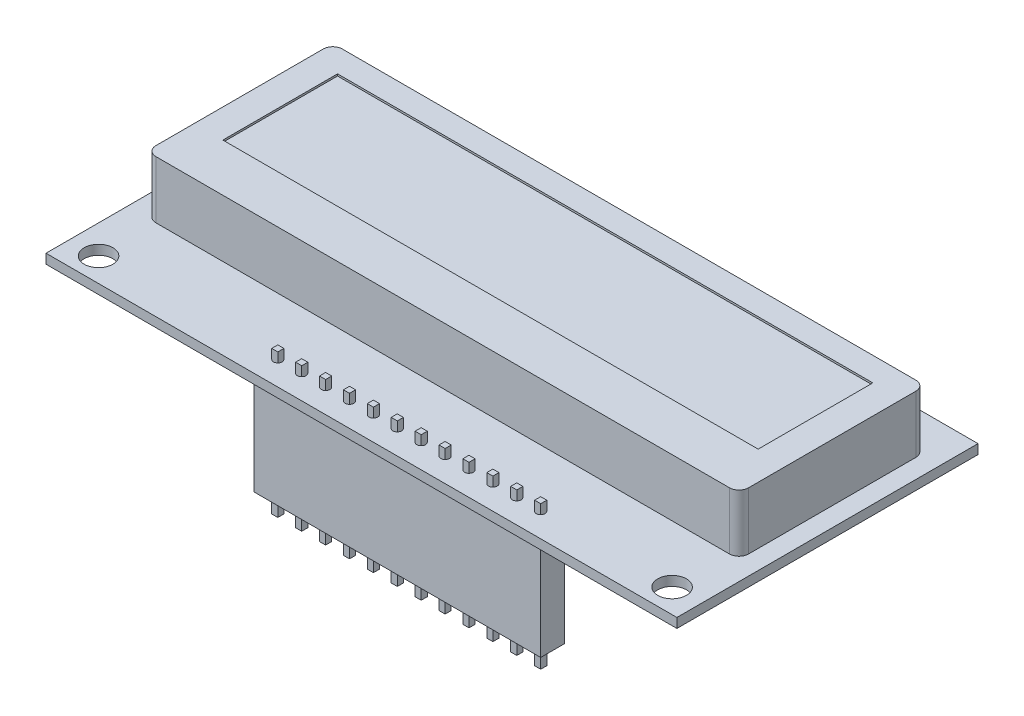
SolidWorks part; units mm, degrees
ref_plane "Front" through (0, 0, 0) normal (0, 0, 1) x (1, 0, 0)
ref_plane "Top" through (0, 0, 0) normal (0, 1, 0) x (1, 0, 0)
ref_plane "Right" through (0, 0, 0) normal (1, 0, 0) x (0, 0, -1)
sketch "Эскиз1" plane through (0, 0, 0) normal (0, 1, 0) x (1, 0, 0)
  line L0 (-33, 0) -> (33, 0) construction
  line L1 (-33, -19.5) -> (33, -19.5)
  line L2 (-33, -19.5) -> (-33, 12)
  line L3 (-33, 12) -> (33, 12)
  line L4 (33, -19.5) -> (33, 12)
  dimension "D1" = 66
  dimension "D2" = 31.5
  dimension "D3" = 19.5
extrude "Вытянуть1" add sketch "Эскиз1" along normal blind 1 from offset 11
sketch "Эскиз2" plane through (0, 12, 0) normal (0, 1, 0) x (1, 0, 0)
  line L0 (-33, -19.5) -> (33, -19.5) construction
  line L1 (31, -11) -> (-31, -11)
  line L2 (31, -11) -> (31, 8.5)
  line L3 (31, 8.5) -> (-31, 8.5)
  line L4 (-31, -11) -> (-31, 8.5)
  line L5 (31, -11) -> (-31, 8.5) construction
  line L6 (31, 8.5) -> (-31, -11) construction
  point P0 (0, -1.25)
  dimension "D1" = 8.5
  dimension "D2" = 19.5
  dimension "D3" = 62
extrude "Вытянуть2" add sketch "Эскиз2" along normal blind 6
fillet "Скругление1" radius 1 4 edges at (31, 15, 11) (31, 15, -8.5) (-31, 15, -8.5) (-31, 15, 11)
sketch "Эскиз3" plane through (0, 18, 0) normal (0, 1, 0) x (1, 0, 0)
  line L0 (-30, -11) -> (30, -11) construction
  line L1 (28, -6) -> (-28, -6)
  line L2 (28, -6) -> (28, 6)
  line L3 (28, 6) -> (-28, 6)
  line L4 (-28, -6) -> (-28, 6)
  line L5 (28, -6) -> (-28, 6) construction
  line L6 (28, 6) -> (-28, -6) construction
  point P0 (0, 0)
  dimension "D1" = 56
  dimension "D2" = 12
  dimension "D3" = 5
extrude "Вытянуть3" cut sketch "Эскиз3" against normal blind 0.2
sketch "Эскиз4" plane through (0, 11, 0) normal (0, -1, 0) x (1, 0, 0)
  line L0 (-2.5, -7.7) -> (-2.5, -8.5)
  line L1 (-26.5, -7.7) -> (-21.5, -7.7)
  line L2 (-26.5, -7.7) -> (-26.5, -8.5)
  line L3 (-26.5, -8.5) -> (-21.5, -8.5)
  line L4 (-21.5, -7.7) -> (-21.5, -8.5)
  line L5 (-26.5, -7.7) -> (-21.5, -8.5) construction
  line L6 (-26.5, -8.5) -> (-21.5, -7.7) construction
  line L7 (-2.5, -8.5) -> (2.5, -8.5)
  line L8 (-2.5, -7.7) -> (2.5, -7.7)
  line L9 (2.5, -7.7) -> (2.5, -8.5)
  line L10 (21.5, -7.7) -> (21.5, -8.5)
  line L11 (21.5, -8.5) -> (26.5, -8.5)
  line L12 (21.5, -7.7) -> (26.5, -7.7)
  line L13 (26.5, -7.7) -> (26.5, -8.5)
  line L14 (-26.5, 11) -> (-26.5, 10.2)
  line L15 (-26.5, 10.2) -> (-21.5, 10.2)
  line L16 (-26.5, 11) -> (-21.5, 11)
  line L17 (-21.5, 11) -> (-21.5, 10.2)
  line L18 (-2.5, 11) -> (-2.5, 10.2)
  line L19 (-2.5, 10.2) -> (2.5, 10.2)
  line L20 (-2.5, 11) -> (2.5, 11)
  line L21 (2.5, 11) -> (2.5, 10.2)
  line L22 (21.5, 11) -> (21.5, 10.2)
  line L23 (21.5, 10.2) -> (26.5, 10.2)
  line L24 (21.5, 11) -> (26.5, 11)
  line L25 (26.5, 11) -> (26.5, 10.2)
  line L26 (0, 0) -> (0, -7.7) construction
  line L30 (31, 11) -> (-31, 11)
  line L31 (-31, 11) -> (-31, -8.5)
  line L32 (-31, -8.5) -> (31, -8.5)
  line L33 (31, -8.5) -> (31, 11)
  line L34 (31, 11) -> (-31, 11) construction
  line L35 (-31, 11) -> (-31, -8.5) construction
  line L36 (-31, -8.5) -> (31, -8.5) construction
  line L37 (31, -8.5) -> (31, 11) construction
  point P0 (-24, -8.1)
  dimension "D2" = 5
  dimension "D3" = 0.8
  dimension "D4" = 24
  dimension "D1" = 0
extrude "Вытянуть4" add sketch "Эскиз4" along normal blind 2.5
hole_wizard "Диаметр отверстия Ø3.0 (3)1" positions "Эскиз6" profile "Эскиз7" hole size "Ø3.0" standard "ГОСТ"
sketch "Эскиз6" plane through (0, 12, 0) normal (0, 1, 0) x (-1, 0, 0)
  line L0 (0, 0) -> (0, 19.5) construction
  line L1 (33, 19.5) -> (-33, 19.5) construction
  point P0 (30, 17)
  point P1 (-30, 17)
  dimension "D1" = 60
  dimension "D2" = 2.5
sketch "Эскиз7" plane through (-30, 12, 17) normal (1, 0, 0) x (0, 0, 1)
  line L0 (0, 0) -> (0, 3.5)
  line L1 (0, 3.5) -> (1.5, 3.5)
  line L2 (1.5, 3.5) -> (1.5, 0)
  line L5 (1.5, 0) -> (0, 0)
  line L11 (0, -6.35) -> (0, 107.95) construction
  dimension "Диаметр сквозного отверстия" = 3
  dimension "Глубина сквозного отверстия" = 3.5
hole_wizard "Диаметр отверстия Ø0.9 (0.9)1" positions "Эскиз9" profile "Эскиз8" hole size "Ø0.9" standard "ГОСТ"
sketch "Эскиз9" plane through (0, 12, 0) normal (0, 1, 0) x (-1, 0, 0)
  line L0 (33, 19.5) -> (-33, 19.5) construction
  point P0 (11.25, 17)
  point P7 (8.75, 17)
  point P8 (6.25, 17)
  point P9 (3.75, 17)
  point P10 (1.25, 17)
  point P11 (-1.25, 17)
  point P12 (-3.75, 17)
  point P13 (-6.25, 17)
  point P14 (-8.75, 17)
  point P15 (-11.25, 17)
  point P16 (-13.75, 17)
  point P17 (-16.25, 17)
  dimension "D1" = 2.5
  dimension "D2" = 2.5
  dimension "D3" = 1.25
sketch "Эскиз8" plane through (-11.25, 12, 17) normal (1, 0, 0) x (0, 0, 1)
  line L0 (0, 0) -> (0, 3.5)
  line L1 (0, 3.5) -> (0.45, 3.5)
  line L2 (0.45, 3.5) -> (0.45, 0)
  line L5 (0.45, 0) -> (0, 0)
  line L11 (0, -6.35) -> (0, 107.95) construction
  dimension "Диаметр сквозного отверстия" = 0.9
  dimension "Глубина сквозного отверстия" = 3.5
sketch "Эскиз10" plane through (0, 11, 0) normal (0, -1, 0) x (1, 0, 0)
  line L0 (-12.5, 17) -> (17.5, 17) construction
  line L1 (-12.5, 15.75) -> (17.5, 15.75)
  line L2 (-12.5, 15.75) -> (-12.5, 18.25)
  line L3 (-12.5, 18.25) -> (17.5, 18.25)
  line L4 (17.5, 15.75) -> (17.5, 18.25)
  dimension "D1" = 2.5
  dimension "D2" = 1.25
  dimension "D3" = 1.25
extrude "Вытянуть5" add sketch "Эскиз10" along normal blind 11
sketch "Эскиз11" plane through (0, 12, 0) normal (0, 1, 0) x (1, 0, 0)
  line L0 (-9.07, -17.32) -> (-9.07, -16.68)
  line L1 (-11.57, -17.32) -> (-10.93, -17.32)
  line L2 (-11.57, -17.32) -> (-11.57, -16.68)
  line L3 (-11.57, -16.68) -> (-10.93, -16.68)
  line L4 (-10.93, -17.32) -> (-10.93, -16.68)
  line L5 (-11.57, -17.32) -> (-10.93, -16.68) construction
  line L6 (-11.57, -16.68) -> (-10.93, -17.32) construction
  line L7 (-9.07, -16.68) -> (-8.43, -16.68)
  line L8 (-8.43, -17.32) -> (-8.43, -16.68)
  line L9 (-9.07, -17.32) -> (-8.43, -17.32)
  line L10 (-6.57, -17.32) -> (-6.57, -16.68)
  line L11 (-6.57, -16.68) -> (-5.93, -16.68)
  line L12 (-5.93, -17.32) -> (-5.93, -16.68)
  line L13 (-6.57, -17.32) -> (-5.93, -17.32)
  line L14 (-4.07, -17.32) -> (-4.07, -16.68)
  line L15 (-4.07, -16.68) -> (-3.43, -16.68)
  line L16 (-3.43, -17.32) -> (-3.43, -16.68)
  line L17 (-4.07, -17.32) -> (-3.43, -17.32)
  line L18 (-1.57, -17.32) -> (-1.57, -16.68)
  line L19 (-1.57, -16.68) -> (-0.93, -16.68)
  line L20 (-0.93, -17.32) -> (-0.93, -16.68)
  line L21 (-1.57, -17.32) -> (-0.93, -17.32)
  line L22 (0.93, -17.32) -> (0.93, -16.68)
  line L23 (0.93, -16.68) -> (1.57, -16.68)
  line L24 (1.57, -17.32) -> (1.57, -16.68)
  line L25 (0.93, -17.32) -> (1.57, -17.32)
  line L26 (3.43, -17.32) -> (3.43, -16.68)
  line L27 (3.43, -16.68) -> (4.07, -16.68)
  line L28 (4.07, -17.32) -> (4.07, -16.68)
  line L29 (3.43, -17.32) -> (4.07, -17.32)
  line L30 (5.93, -17.32) -> (5.93, -16.68)
  line L31 (5.93, -16.68) -> (6.57, -16.68)
  line L32 (6.57, -17.32) -> (6.57, -16.68)
  line L33 (5.93, -17.32) -> (6.57, -17.32)
  line L34 (8.43, -17.32) -> (8.43, -16.68)
  line L35 (8.43, -16.68) -> (9.07, -16.68)
  line L36 (9.07, -17.32) -> (9.07, -16.68)
  line L37 (8.43, -17.32) -> (9.07, -17.32)
  line L38 (10.93, -17.32) -> (10.93, -16.68)
  line L39 (10.93, -16.68) -> (11.57, -16.68)
  line L40 (11.57, -17.32) -> (11.57, -16.68)
  line L41 (10.93, -17.32) -> (11.57, -17.32)
  line L42 (13.43, -17.32) -> (13.43, -16.68)
  line L43 (13.43, -16.68) -> (14.07, -16.68)
  line L44 (14.07, -17.32) -> (14.07, -16.68)
  line L45 (13.43, -17.32) -> (14.07, -17.32)
  line L46 (15.93, -17.32) -> (15.93, -16.68)
  line L47 (15.93, -16.68) -> (16.57, -16.68)
  line L48 (16.57, -17.32) -> (16.57, -16.68)
  line L49 (15.93, -17.32) -> (16.57, -17.32)
  point P0 (-11.25, -17)
  dimension "D1" = 0.64
  dimension "D2" = 2.5
extrude "Вытянуть6" add sketch "Эскиз11" along normal blind 1 and the other way blind 14
